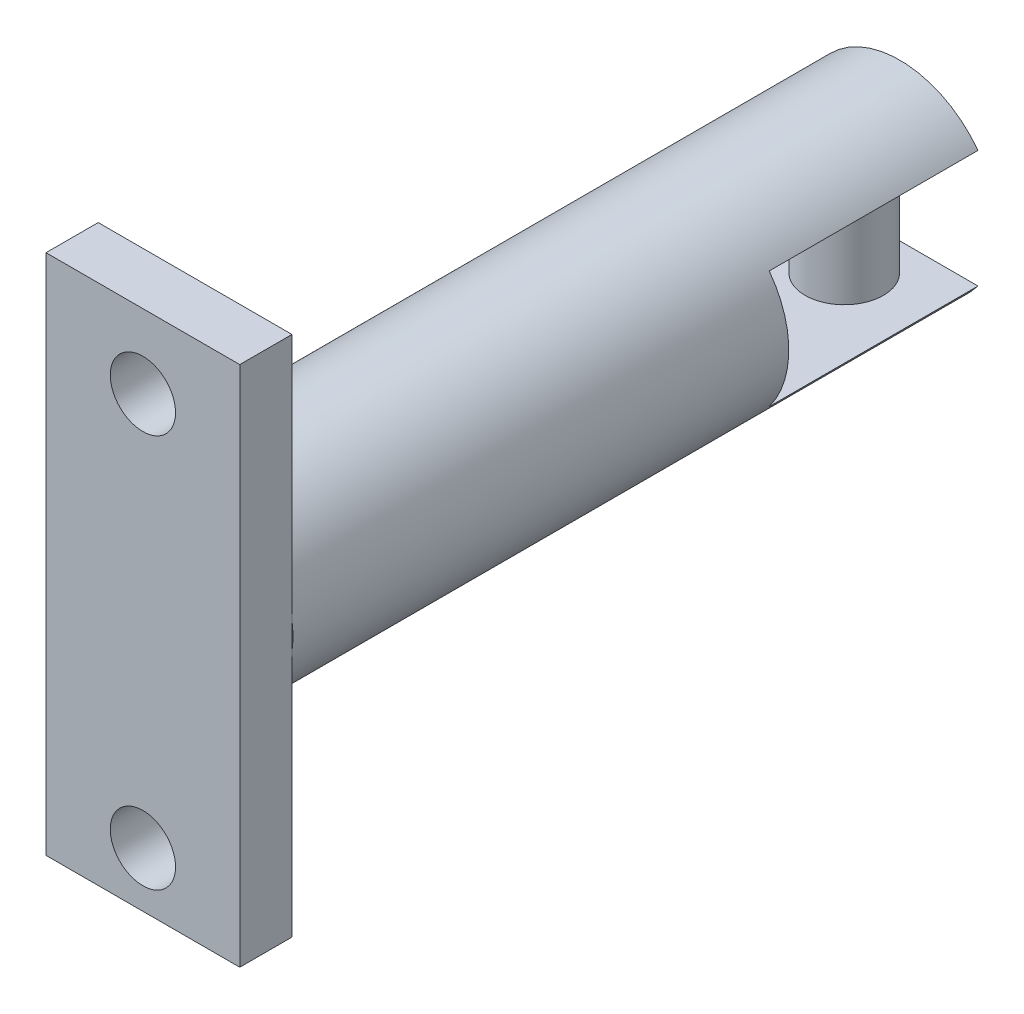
SolidWorks part; units mm, degrees
ref_plane "Front Plane" through (0, 0, 0) normal (0, 0, 1) x (1, 0, 0)
ref_plane "Top Plane" through (0, 0, 0) normal (0, 1, 0) x (1, 0, 0)
ref_plane "Right Plane" through (0, 0, 0) normal (1, 0, 0) x (0, 0, -1)
sketch "Sketch1" plane through (0, 0, 0) normal (0, 0, 1) x (1, 0, 0)
  circle A0 centre (0, 0) radius 7.5
  dimension "D1" = 15
extrude "Boss-Extrude1" add sketch "Sketch1" along normal blind 54
sketch "Sketch2" plane through (0, 0, 0) normal (0, 0, 1) x (1, 0, 0)
  line L1 (-8.1513, 4.5) -> (8.1513, 4.5)
  line L2 (-8.1513, 4.5) -> (-8.1513, -4.5)
  line L3 (-8.1513, -4.5) -> (8.1513, -4.5)
  line L4 (8.1513, 4.5) -> (8.1513, -4.5)
  line L5 (-8.1513, 4.5) -> (8.1513, -4.5) construction
  line L6 (-8.1513, -4.5) -> (8.1513, 4.5) construction
  point P0 (0, 0)
  dimension "D1" = 9
extrude "Cut-Extrude1" cut sketch "Sketch2" along normal blind 16
ref_plane "Plane1" through (0, 4.5, 0) normal (0, -1, 0) x (-1, 0, 0)
sketch "Sketch3" plane through (0, 4.5, 0) normal (0, -1, 0) x (-1, 0, 0)
  circle A0 centre (0, -4.2481) radius 3
  dimension "D1" = 6
extrude "Boss-Extrude3" add sketch "Sketch3" along normal blind 11
ref_plane "Plane2" through (0, 0, 54) normal (0, 0, 1) x (1, 0, 0)
sketch "Sketch4" plane through (0, 0, 54) normal (0, 0, 1) x (1, 0, 0)
  line L1 (7.425, 20) -> (-7.425, 20)
  line L2 (7.425, 20) -> (7.425, -20)
  line L3 (7.425, -20) -> (-7.425, -20)
  line L4 (-7.425, 20) -> (-7.425, -20)
  line L5 (7.425, 20) -> (-7.425, -20) construction
  line L6 (7.425, -20) -> (-7.425, 20) construction
  circle A0 centre (0, -15.8033) radius 2.5
  circle A1 centre (0, 14.3421) radius 2.5
  point P0 (0, 0)
  dimension "D2" = 5
  dimension "D3" = 5
  dimension "D1" = 40
extrude "Boss-Extrude4" add sketch "Sketch4" along normal blind 4
